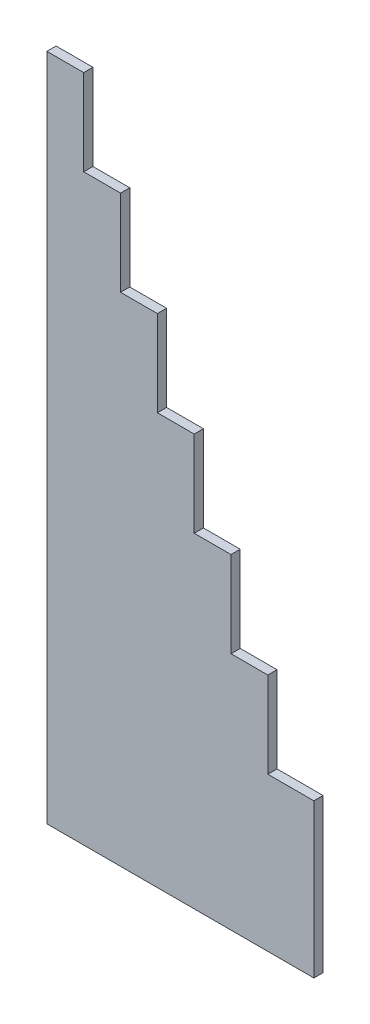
SolidWorks part; units mm, degrees
ref_plane "Plano frontal" through (0, 0, 0) normal (0, 0, 1) x (1, 0, 0)
ref_plane "Plano superior" through (0, 0, 0) normal (0, 1, 0) x (1, 0, 0)
ref_plane "Plano direito" through (0, 0, 0) normal (1, 0, 0) x (0, 0, -1)
sketch "Esboço3" plane through (0, 0, 0) normal (0, 0, 1) x (1, 0, 0)
  line L0 (-1000, 0) -> (49000, 0) construction
  line L1 (-523, -1126) -> (49477, -1126) construction
  line L2 (432, -1126) -> (522, -1126) construction
  line L5 (-523, -1426) -> (49477, -1426) construction
  line L7 (522, -2126) -> (522, 47874) construction
  line L8 (22, -2126) -> (22, 47874) construction
  line L9 (0, -118) -> (0, -1426)
  line L10 (0, -1426) -> (522, -1426)
  line L11 (522, -1426) -> (522, -1126)
  line L12 (522, -1126) -> (432, -1126)
  line L13 (432, -1126) -> (432, -958)
  line L14 (432, -958) -> (360, -958)
  line L15 (360, -958) -> (360, -790)
  line L16 (360, -790) -> (288, -790)
  line L17 (288, -790) -> (288, -622)
  line L18 (288, -622) -> (216, -622)
  line L19 (216, -622) -> (216, -454)
  line L20 (216, -454) -> (144, -454)
  line L21 (144, -454) -> (144, -286)
  line L22 (144, -286) -> (72, -286)
  line L23 (72, -286) -> (72, -118)
  line L24 (72, -118) -> (0, -118)
  point P9 (477, -1126)
  point P33 (0, 0)
  dimension "D2" = 500
  dimension "D1" = 300
extrude "Ressalto-extrusão2" add sketch "Esboço3" against normal blind 18
